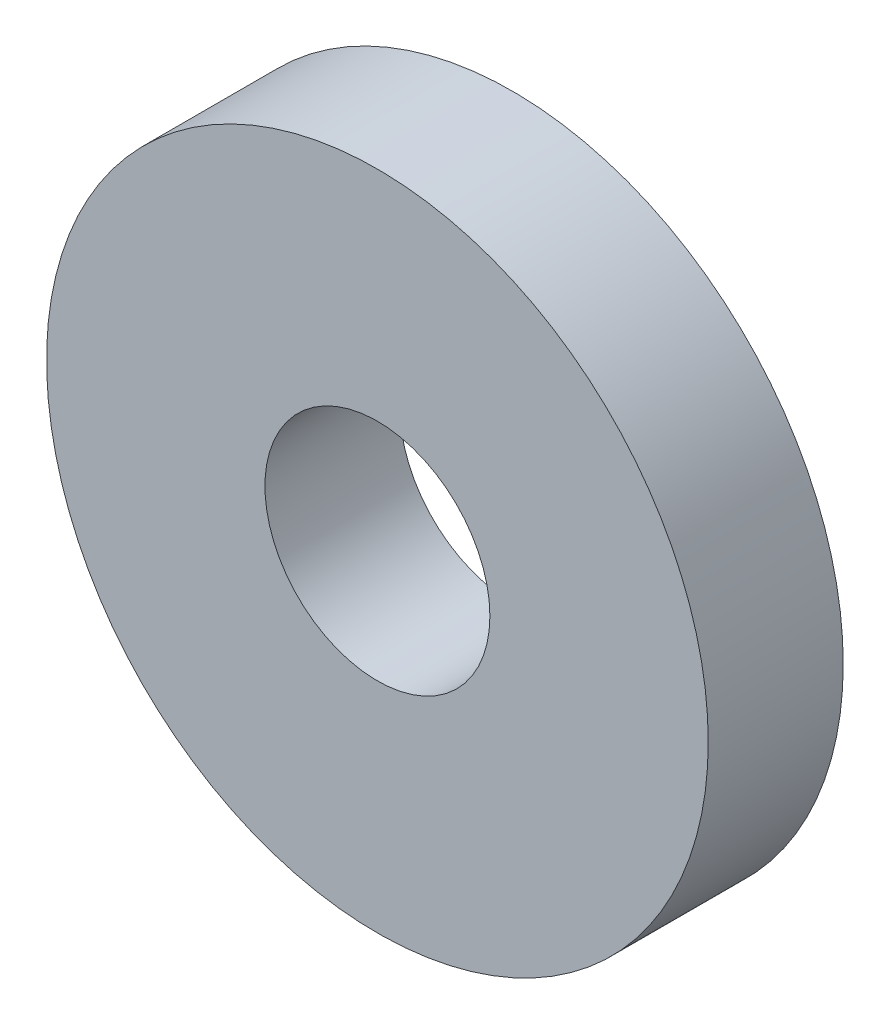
SolidWorks part; units mm, degrees
ref_plane "Front Plane" through (0, 0, 0) normal (0, 0, 1) x (1, 0, 0)
ref_plane "Top Plane" through (0, 0, 0) normal (0, 1, 0) x (1, 0, 0)
ref_plane "Right Plane" through (0, 0, 0) normal (1, 0, 0) x (0, 0, -1)
ref_plane "Plane1"
sketch "Sketch1" plane through (0, 0, 0) normal (0, 0, 1) x (1, 0, 0)
  circle A0 centre (0, 0) radius 12.5
  circle A1 centre (0, 0) radius 4.25
  dimension "D1" = 8.5
  dimension "D2" = 25
extrude "Extrusion1" add sketch "Sketch1" along normal blind 5.1 contours A0 A1
